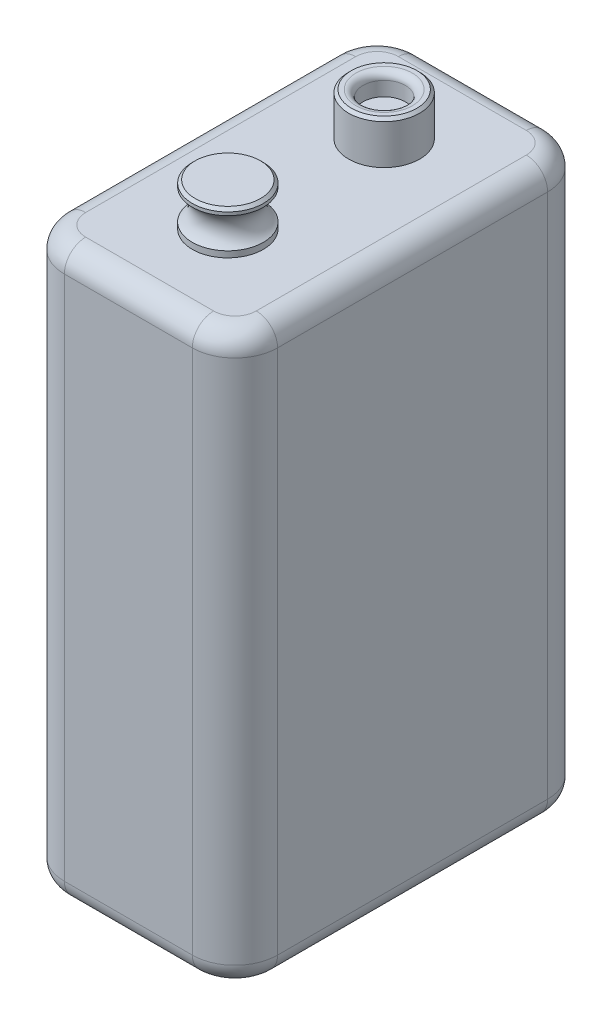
SolidWorks part; units mm, degrees
ref_plane "Alzado" through (0, 0, 0) normal (0, 0, 1) x (1, 0, 0)
ref_plane "Planta" through (0, 0, 0) normal (0, 1, 0) x (1, 0, 0)
ref_plane "Vista lateral" through (0, 0, 0) normal (1, 0, 0) x (0, 0, -1)
sketch "Croquis1" plane through (0, 0, 0) normal (0, 1, 0) x (1, 0, 0)
  line L1 (-7.5, 12.5) -> (7.5, 12.5)
  line L2 (-7.5, 12.5) -> (-7.5, -12.5)
  line L3 (-7.5, -12.5) -> (7.5, -12.5)
  line L4 (7.5, 12.5) -> (7.5, -12.5)
  line L5 (-7.5, 12.5) -> (7.5, -12.5) construction
  line L6 (-7.5, -12.5) -> (7.5, 12.5) construction
  point P0 (0, 0)
  dimension "D1" = 25
  dimension "D2" = 15
extrude "Saliente-Extruir1" add sketch "Croquis1" along normal blind 40
fillet "Redondeo1" radius 3 4 edges at (-7.5, 20, -12.5) (7.5, 20, -12.5) (-7.5, 20, 12.5) (7.5, 20, 12.5)
fillet "Redondeo2" radius 1.5 8 edges at (6.6213, 0, 11.6213) (0, 0, 12.5) (-6.6213, 0, 11.6213) (-7.5, 0, 0) (-6.6213, 0, -11.6213) (0, 0, -12.5) (6.6213, 0, -11.6213) (7.5, 0, 0)
fillet "Redondeo3" radius 1.5 8 edges at (6.6213, 40, 11.6213) (0, 40, 12.5) (-6.6213, 40, 11.6213) (-7.5, 40, 0) (-6.6213, 40, -11.6213) (0, 40, -12.5) (6.6213, 40, -11.6213) (7.5, 40, 0)
sketch "Croquis2" plane through (0, 40, 0) normal (0, 1, 0) x (1, 0, 0)
  line L0 (0, 11) -> (0, -11) construction
  line L1 (4.5, 11) -> (-4.5, 11) construction
  line L2 (-4.5, -11) -> (4.5, -11) construction
  line L3 (0, 0) -> (6, 0) construction
  line L4 (6, -9.5) -> (6, 9.5) construction
  circle A0 centre (0, 5.5) radius 2.5
  circle A1 centre (0, -5.5) radius 2.5
  dimension "D2" = 5
  dimension "D1" = 5.5
extrude "Saliente-Extruir2" add sketch "Croquis2" along normal blind 3
sketch "Croquis3" plane through (0, 43, 0) normal (0, 1, 0) x (1, 0, 0)
  circle A0 centre (0, 5.5) radius 1.4874
extrude "Cortar-Extruir1" cut sketch "Croquis3" against normal blind 1.5
fillet "Redondeo4" radius 0.5 1 edges at (0, 43, -4.0126)
chamfer "Chaflán1" distance 0.2 angle 45 1 edges at (0, 43, -3)
sketch "Croquis4" plane through (0, 0, 0) normal (1, 0, 0) x (0, 0, -1)
  circle A0 centre (-2.2609, 41.5) radius 1.2992
revolve "Cortar-Revolución1" cut sketch "Croquis4" angle 360 about axis through (0, 43, 5.5) along (0, -1, 0)
chamfer "Chaflán2" distance 0.2 angle 45 1 edges at (0, 43, 3)
